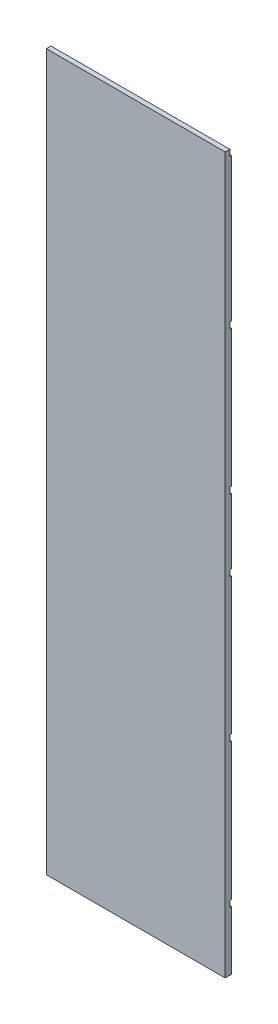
SolidWorks part; units mm, degrees
ref_plane "Plano frontal" through (0, 0, 0) normal (0, 0, 1) x (1, 0, 0)
ref_plane "Plano superior" through (0, 0, 0) normal (0, 1, 0) x (1, 0, 0)
ref_plane "Plano direito" through (0, 0, 0) normal (1, 0, 0) x (0, 0, -1)
body saved out of another part "Bruto-Lateral Movel 1-1"
